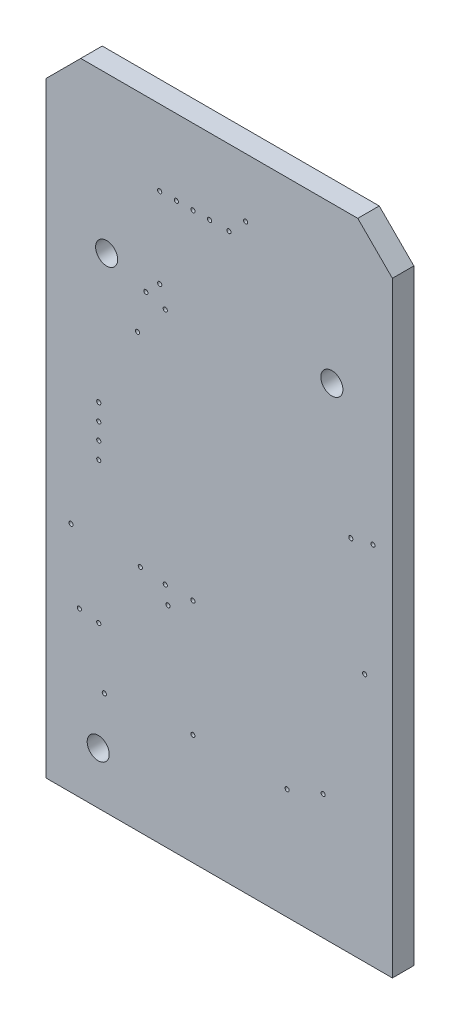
SolidWorks part; units mm, degrees
ref_plane "Front Plane" through (0, 0, 0) normal (0, 0, 1) x (1, 0, 0)
ref_plane "Top Plane" through (0, 0, 0) normal (0, 1, 0) x (1, 0, 0)
ref_plane "Right Plane" through (0, 0, 0) normal (1, 0, 0) x (0, 0, -1)
ref_plane "Dielectric_Layer Layer 1" through (0, 0, 0.7874) normal (0, 0, 1) x (1, 0, 0)
sketch "Sketch1" plane through (0, 0, 0) normal (0, 0, 1) x (1, 0, 0)
  line L0 (0, 0) -> (0, 22.225)
  line L1 (0, 22.225) -> (1.27, 23.495)
  line L2 (1.27, 23.495) -> (11.43, 23.495)
  line L3 (11.43, 23.495) -> (12.7, 22.225)
  line L4 (12.7, 22.225) -> (12.7, 0)
  line L5 (12.7, 0) -> (0, 0)
extrude "Board_Outline" add sketch "Sketch1" along normal blind 0.7874 separate body
sketch "Sketch2" plane through (0, 0, 0) normal (0, 0, 1) x (1, 0, 0)
  circle A0 centre (1.2192, 5.9944) radius 0.0762
  circle A1 centre (10.16, 4.572) radius 0.0762
  circle A2 centre (11.684, 9.144) radius 0.0762
  circle A3 centre (4.3688, 8.3312) radius 0.0762
  circle A4 centre (1.9304, 11.684) radius 0.0762
  circle A5 centre (7.3152, 21.336) radius 0.0762
  circle A6 centre (6.7056, 20.7264) radius 0.0762
  circle A7 centre (11.176, 13.208) radius 0.0762
  circle A8 centre (3.4544, 8.4328) radius 0.0762
  circle A9 centre (2.1336, 3.7592) radius 0.0762
  circle A10 centre (4.4704, 7.7216) radius 0.0762
  circle A11 centre (8.8392, 4.064) radius 0.0762
  circle A12 centre (5.3848, 20.7264) radius 0.0762
  circle A13 centre (3.3528, 15.8496) radius 0.0762
  circle A14 centre (4.7752, 20.7264) radius 0.0762
  circle A15 centre (4.3688, 17.0688) radius 0.0762
  circle A16 centre (4.1656, 20.7264) radius 0.0762
  circle A17 centre (4.1656, 17.78) radius 0.0762
  circle A18 centre (5.9944, 20.7264) radius 0.0762
  circle A19 centre (3.6576, 17.272) radius 0.0762
  circle A20 centre (5.3848, 8.3312) radius 0.0762
  circle A21 centre (5.3848, 4.064) radius 0.0762
  circle A22 centre (1.9304, 12.2936) radius 0.0762
  circle A23 centre (1.9304, 5.8928) radius 0.0762
  circle A24 centre (0.9144, 8.5344) radius 0.0762
  circle A25 centre (1.9304, 12.9032) radius 0.0762
  circle A26 centre (1.9304, 11.0744) radius 0.0762
  circle A27 centre (11.9888, 13.4112) radius 0.0762
extrude "NPTH" cut sketch "Sketch2" along normal through all
sketch "Sketch3" plane through (0, 0, 0) normal (0, 0, 1) x (1, 0, 0)
  circle A0 centre (2.22, 17.78) radius 0.405
  circle A1 centre (10.48, 17.78) radius 0.405
  circle A2 centre (1.91, 1.91) radius 0.405
extrude "PTH" cut sketch "Sketch3" along normal through all
